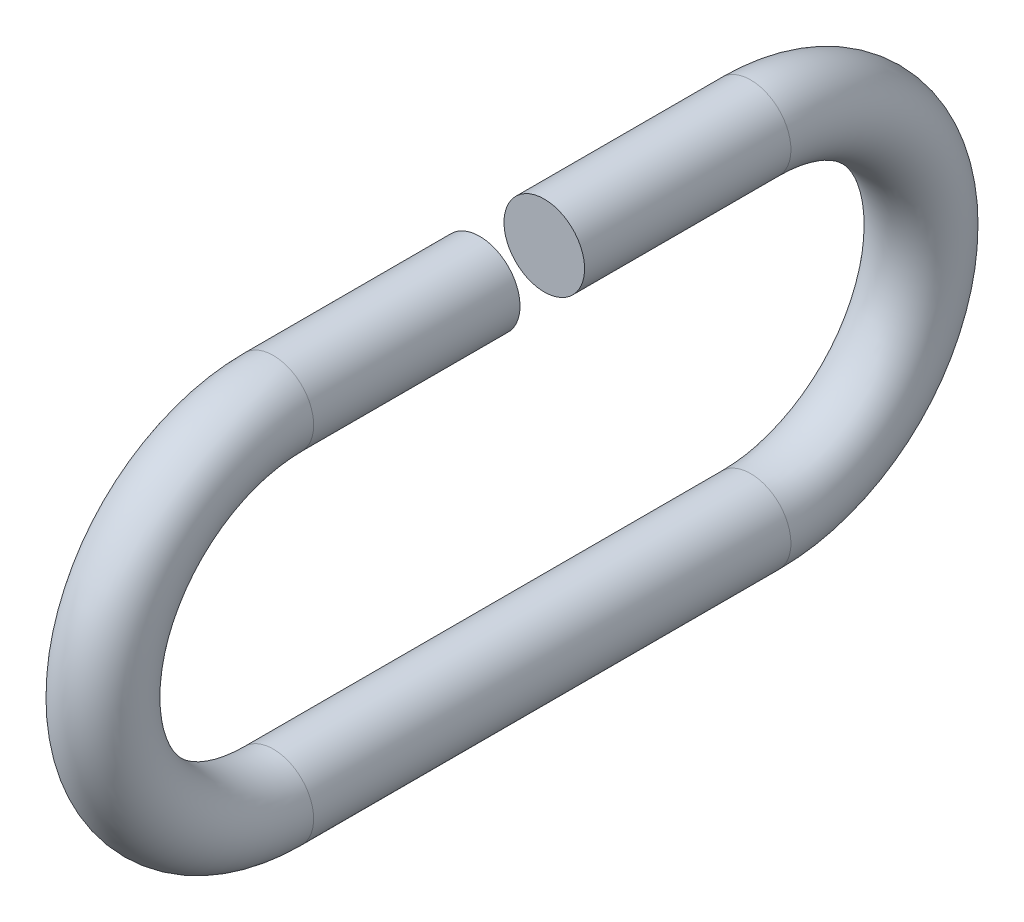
SolidWorks part; units mm, degrees
ref_plane "Front Plane" through (0, 0, 0) normal (0, 0, 1) x (1, 0, 0)
ref_plane "Top Plane" through (0, 0, 0) normal (0, 1, 0) x (1, 0, 0)
ref_plane "Right Plane" through (0, 0, 0) normal (1, 0, 0) x (0, 0, -1)
sketch "Sketch1" plane through (0, 0, 0) normal (1, 0, 0) x (0, 0, -1)
  line L0 (-11.7348, 0) -> (11.7348, 0) construction
  line L1 (-11.7348, 8.382) -> (11.7348, 8.382)
  line L2 (-11.7348, -8.382) -> (11.7348, -8.382)
  line L3 (-20.1168, 0) -> (20.1168, 0) construction
  arc A0 (-11.7348, 8.382) -> (-11.7348, -8.382) centre (-11.7348, 0) ccw
  arc A1 (11.7348, -8.382) -> (11.7348, 8.382) centre (11.7348, 0) ccw
  point P2 (0, 0)
  dimension "D1" = 8.382
  dimension "D2" = 40.2336
sketch "Sketch2" plane through (0, 0, 0) normal (0, 0, 1) x (1, 0, 0)
  line L0 (0, -8.382) -> (0, 8.382) construction
  circle A0 centre (0, 8.382) radius 1.9812
  dimension "D1" = 3.9624
sweep "Sweep1" add profiles "Sketch2" path "Sketch1"
sketch "Sketch3" plane through (0, 0, 0) normal (1, 0, 0) x (0, 0, -1)
  line L0 (0, 10.3632) -> (0, 6.4008) construction
  line L1 (-1.5875, 10.922) -> (1.5875, 10.922)
  line L2 (-1.5875, 10.922) -> (-1.5875, 5.842)
  line L3 (-1.5875, 5.842) -> (1.5875, 5.842)
  line L4 (1.5875, 10.922) -> (1.5875, 5.842)
  line L5 (-1.5875, 10.922) -> (1.5875, 5.842) construction
  line L6 (-1.5875, 5.842) -> (1.5875, 10.922) construction
  point P0 (0, 8.382)
  dimension "D1" = 3.175
  dimension "D2" = 5.08
extrude "Cut-Extrude1" cut sketch "Sketch3" against normal through all both and the other way through all
